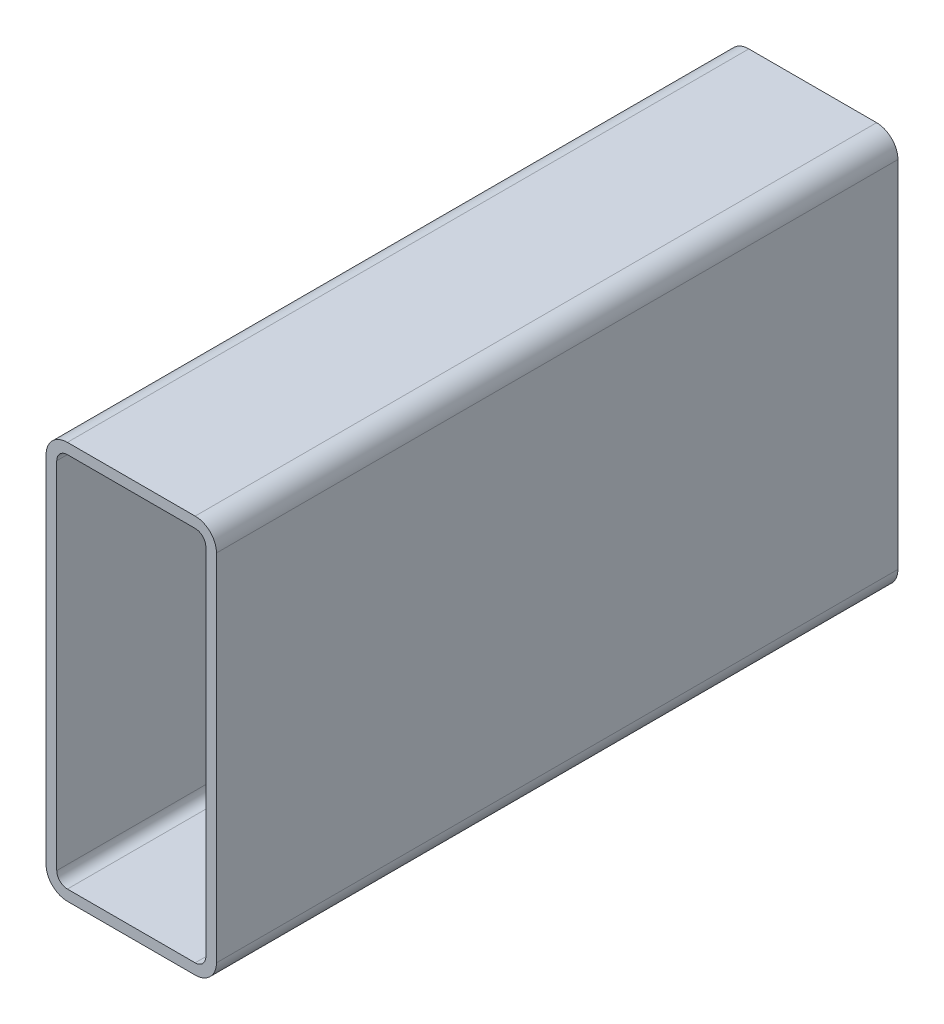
SolidWorks part; units mm, degrees
ref_plane "Front Plane" through (0, 0, 0) normal (0, 0, 1) x (1, 0, 0)
ref_plane "Top Plane" through (0, 0, 0) normal (0, 1, 0) x (1, 0, 0)
ref_plane "Right Plane" through (0, 0, 0) normal (1, 0, 0) x (0, 0, -1)
sketch "Sketch1" plane through (0, 0, 0) normal (0, 0, 1) x (1, 0, 0)
sketch_block_instance "HSS7x3x0.1875-1"
sketch_block "HSS7x3x0.1875"
extrude "Boss-Extrude1" add sketch "Sketch1" along normal blind 304.8
